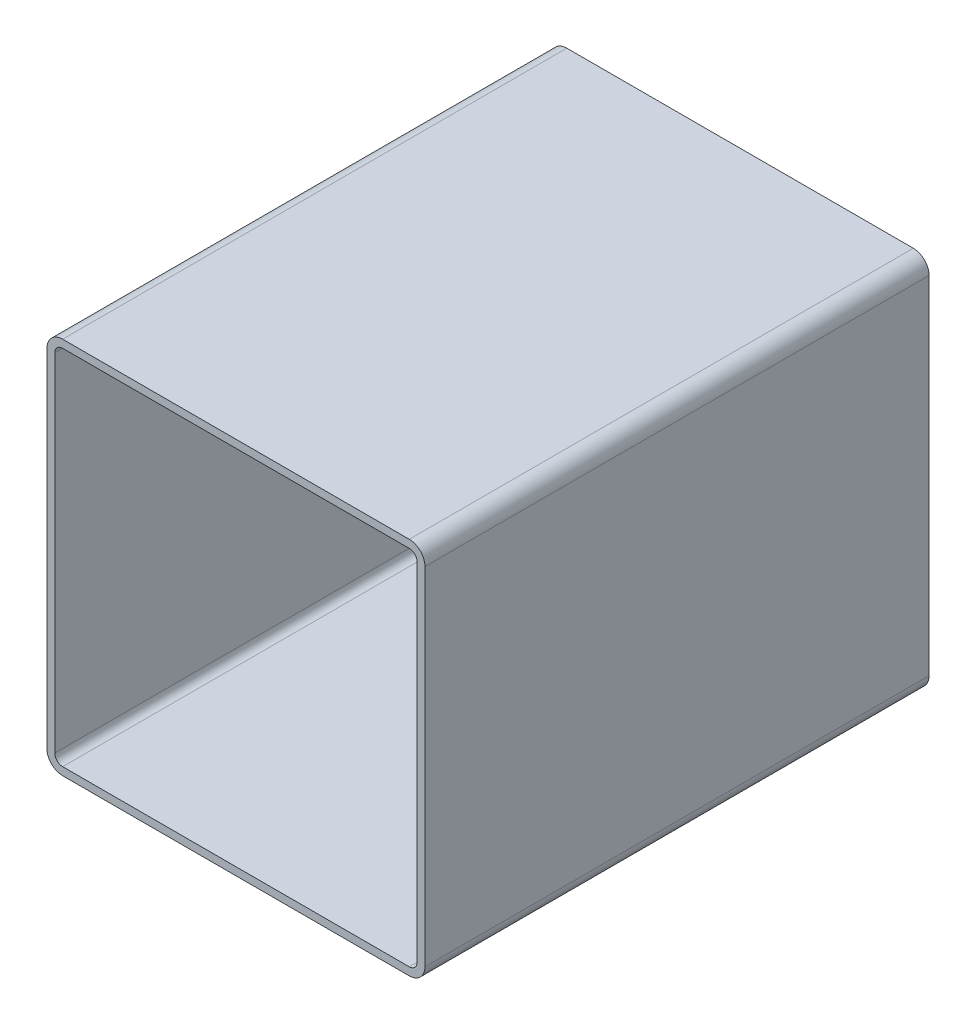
SolidWorks part; units mm, degrees
ref_plane "Front Plane" through (0, 0, 0) normal (0, 0, 1) x (1, 0, 0)
ref_plane "Top Plane" through (0, 0, 0) normal (0, 1, 0) x (1, 0, 0)
ref_plane "Right Plane" through (0, 0, 0) normal (1, 0, 0) x (0, 0, -1)
sketch "Sketch1" plane through (0, 0, 0) normal (0, 0, 1) x (1, 0, 0)
sketch_block_instance "HSS9x9x0.1875-1"
sketch_block "HSS9x9x0.1875"
extrude "Boss-Extrude1" add sketch "Sketch1" along normal blind 304.8
